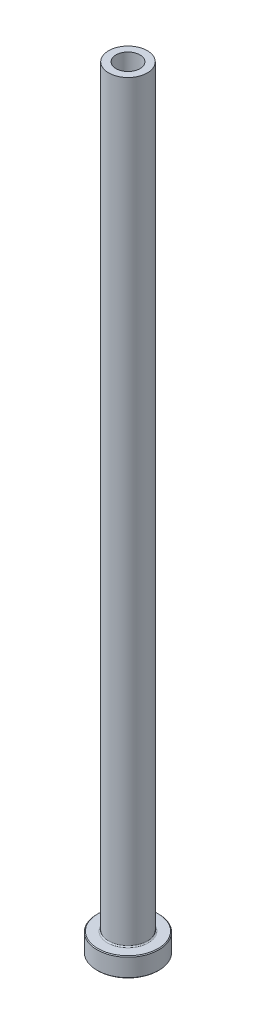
SolidWorks part; units mm, degrees
ref_plane "Front Plane" through (0, 0, 0) normal (0, 0, 1) x (1, 0, 0)
ref_plane "Top Plane" through (0, 0, 0) normal (0, 1, 0) x (1, 0, 0)
ref_plane "Right Plane" through (0, 0, 0) normal (1, 0, 0) x (0, 0, -1)
sketch "Sketch1" plane through (0, 0, 0) normal (0, 0, 1) x (1, 0, 0)
  line L0 (-3.1, 200) -> (-5, 200)
  line L1 (-5, 200) -> (-5, 5)
  line L2 (-5, 5) -> (-8, 5)
  line L3 (-8, 5) -> (-8, 0)
  line L4 (8.8, 0) -> (-8.8, 0) construction
  line L5 (-8, 0) -> (-3.35, 0)
  line L6 (-3.1, 155) -> (-3.1, 200)
  line L7 (0, 92.1877) -> (0, -15.5353) construction
  line L8 (0, -8.8) -> (0, 8.8) construction
  line L9 (-3.1, 155) -> (-3.35, 143)
  line L10 (-3.35, 143) -> (-3.35, 0)
  dimension "D1" = 0.25
  dimension "ID" = 6.2
  dimension "OD" = 10
  dimension "L" = 200
  dimension "H" = 16
  dimension "T" = 5
  dimension "N" = 45
  dimension "D2" = 12
revolve "Revolve1" add sketch "Sketch1" angle 360 about L7
fillet "Fillet1" radius 0.3 1 edges at (0, 5, 5)
chamfer "Chamfer1" distance 0.2 angle 45 2 edges at (0, 5, 8) (0, 0, 8)
chamfer "Chamfer3" distance 0.5 angle 45 1 edges at (0, 0, 3.35)
